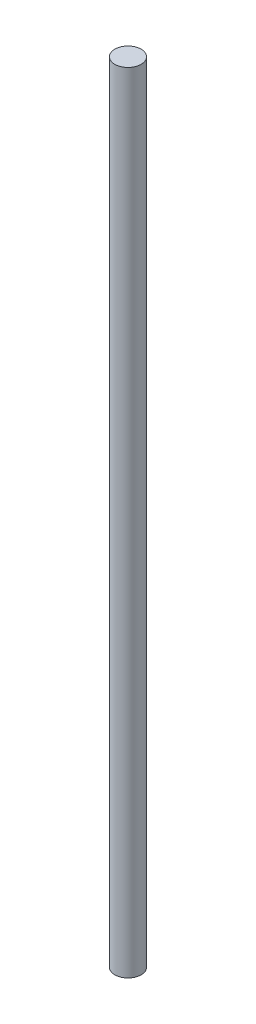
SolidWorks part; units mm, degrees
ref_plane "Front" through (0, 0, 0) normal (0, 0, 1) x (1, 0, 0)
ref_plane "Top" through (0, 0, 0) normal (0, 1, 0) x (1, 0, 0)
ref_plane "Right" through (0, 0, 0) normal (1, 0, 0) x (0, 0, -1)
sketch "Sketch1" plane through (0, 0, 0) normal (0, 1, 0) x (1, 0, 0)
  circle A0 centre (0, 0) radius 1.25
  dimension "D1" = 2.5
extrude "Extrude1" add sketch "Sketch1" along normal blind 75
